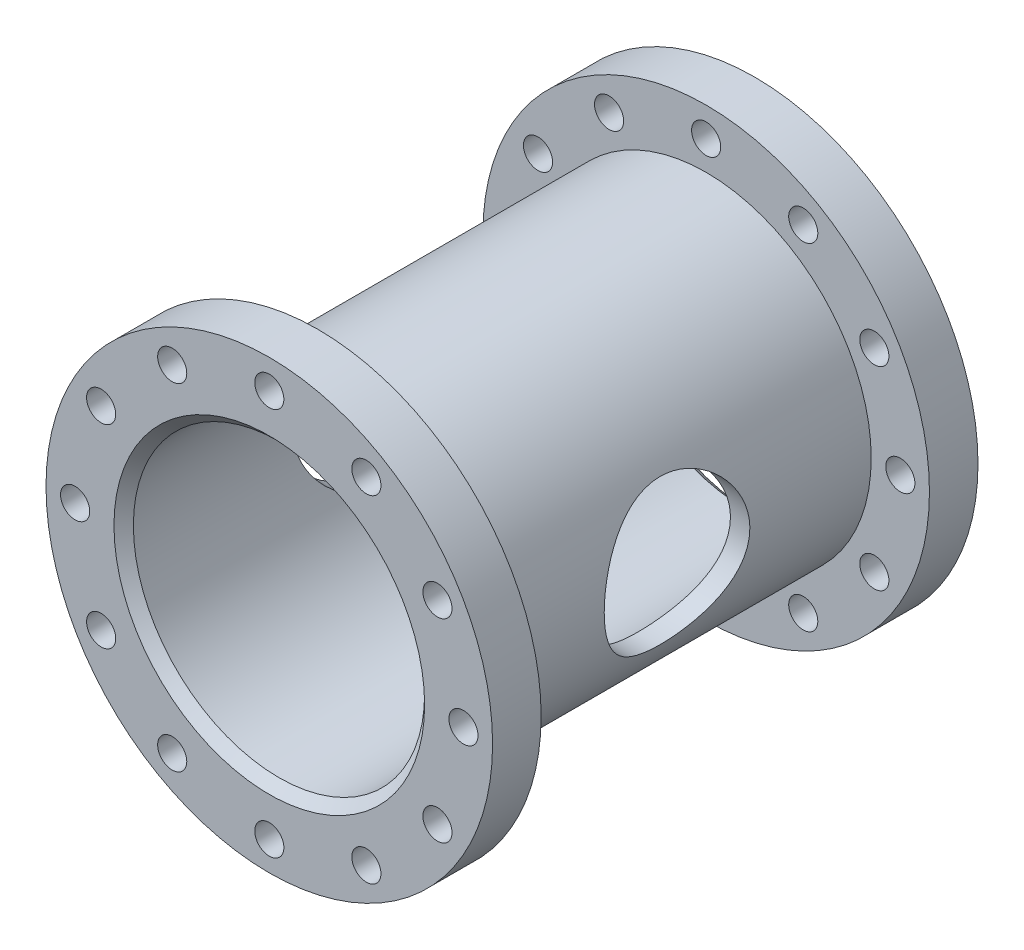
SolidWorks part; units mm, degrees
ref_plane "Front Plane" through (0, 0, 0) normal (0, 0, 1) x (1, 0, 0)
ref_plane "Top Plane" through (0, 0, 0) normal (0, 1, 0) x (1, 0, 0)
ref_plane "Right Plane" through (0, 0, 0) normal (1, 0, 0) x (0, 0, -1)
sketch "Sketch1" plane through (0, 0, 0) normal (0, 0, 1) x (1, 0, 0)
  circle A0 centre (0, 0) radius 75
  circle A1 centre (0, 0) radius 85
  dimension "D1" = 10
  dimension "D2" = 150
extrude "Boss-Extrude1" add sketch "Sketch1" along normal blind 100
sketch "Sketch2" plane through (0, 0, 100) normal (0, 0, 1) x (1, 0, 0)
  circle A0 centre (0, 0) radius 115
  circle A1 centre (0, 0) radius 75 construction
  circle A2 centre (0, 0) radius 75
  dimension "D1" = 40
extrude "Boss-Extrude2" add sketch "Sketch2" along normal blind 25
hole_wizard "Ø15.0 (15) Diameter Hole1" positions "Sketch3" profile "Sketch4" hole size "Ø15.0" standard "ANSI Metric"
sketch "Sketch3" plane through (0, 0, 125) normal (0, 0, 1) x (1, 0, 0)
  line L0 (0, 0) -> (0, 100) construction
  circle A1 centre (0, 0) radius 115 construction
  point P0 (0, 100)
  dimension "D1" = 15
sketch "Sketch4" plane through (0, 100, 125) normal (1, 0, 0) x (0, -1, 0)
  line L0 (0, 0) -> (0, 25.001)
  line L1 (0, 25.001) -> (7.5, 25.001)
  line L2 (7.5, 25.001) -> (7.5, 0)
  line L5 (7.5, 0) -> (0, 0)
  line L11 (0, -6.35) -> (0, 107.95) construction
  dimension "Thru Hole Dia." = 15
  dimension "Thru Hole Depth" = 25.001
pattern_circular "CirPattern1" count 12 over 360 about axis through (0, 0, 0) along (0, 0, 1) of "Ø15.0 (15) Diameter Hole1"
sketch "Sketch6" [suppressed] plane through (0, 0, 125) normal (0, 0, 1) x (1, 0, 0)
  circle A0 centre (0, 0) radius 75 construction
  circle A1 centre (0, 0) radius 115
  circle A2 centre (0, 0) radius 115
  circle A3 centre (0, 0) radius 75
  dimension "D1" = 0
extrude "FACE-MATERIAL" [suppressed] add sketch "Sketch6" along normal blind 5
chamfer "Chamfer1" distance 5 angle 45 1 edges at (75, 0, 125)
mirror "Mirror1" about plane through (0, 0, 0) normal (0, 0, 1)
sketch "Sketch5" plane through (0, 0, 0) normal (1, 0, 0) x (0, 0, -1)
  circle A0 centre (0, 0) radius 37.5
  dimension "D1" = 75
extrude "Cut-Extrude1" cut sketch "Sketch5" against normal through all both and the other way through all
equation "\"A\"= 100"
equation "\"B\"= 100"
equation "\"C\"= 100"
equation "\"D\"= 100"
equation "\"E\"= 100"
